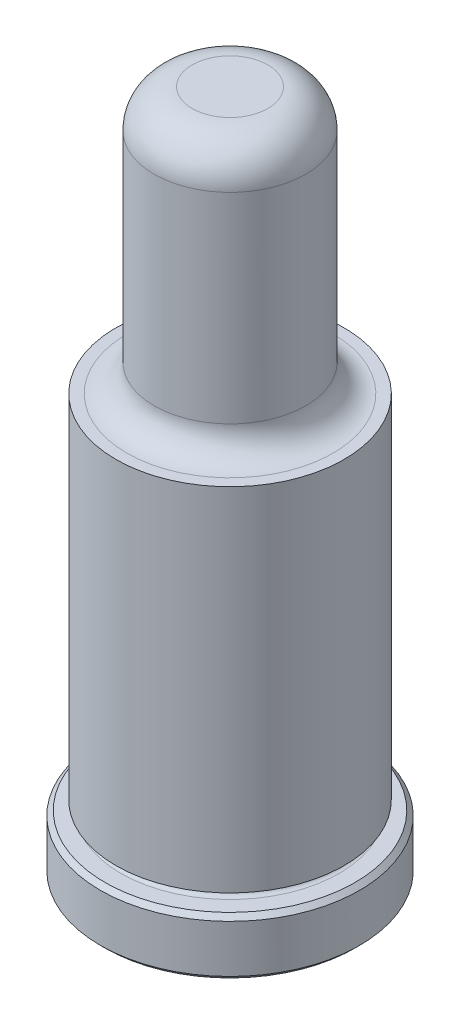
SolidWorks part; units mm, degrees
ref_plane "Front Plane" through (0, 0, 0) normal (0, 0, 1) x (1, 0, 0)
ref_plane "Top Plane" through (0, 0, 0) normal (0, 1, 0) x (1, 0, 0)
ref_plane "Right Plane" through (0, 0, 0) normal (1, 0, 0) x (0, 0, -1)
sketch "Sketch1" plane through (0, 0, 0) normal (1, 0, 0) x (0, 0, -1)
  line L0 (0, 0) -> (10.8331, 0)
  line L1 (10.8331, 0) -> (10.8331, 4.7498)
  line L2 (10.8331, 4.7498) -> (9.1313, 4.7498)
  line L3 (8.7503, 2.6782) -> (8.7503, 5.9795) construction
  line L4 (9.1313, 5.5118) -> (9.5377, 5.5118)
  line L5 (9.5377, 5.5118) -> (9.5377, 34.925)
  line L6 (9.5377, 34.925) -> (8.6233, 34.925)
  line L7 (6.3373, 37.211) -> (6.3373, 57.15)
  line L9 (6.3373, 57.15) -> (0, 57.15)
  line L10 (0, 57.15) -> (0, 0)
  line L11 (0, 0) -> (0, -7.2694) construction
  arc A0 (9.1313, 5.5118) -> (9.1313, 4.7498) centre (9.1313, 5.1308) ccw
  arc A1 (8.6233, 34.925) -> (6.3373, 37.211) centre (8.6233, 37.211) cw
  point P2 (6.3373, 57.15)
  point P14 (6.3373, 57.0292)
  point P19 (6.3373, 34.925)
  point P20 (6.3373, 57.2387)
  dimension "D14" = 0.762
  dimension "D8" = 2.286
  dimension "T" = 4.7498
  dimension "D2" = 0.762
  dimension "M" = 21.6662
  dimension "B" = 19.0754
  dimension "L" = 57.15
  dimension "D7" = 0.7874
  dimension "A" = 34.925
  dimension "D" = 12.6746
  dimension "D15" = 22.225
revolve "Revolve1" add sketch "Sketch1" angle 360 about L11
chamfer "Chamfer1" distance 0.381 angle 45 2 edges at (0, 0, 10.8331) (0, 4.7498, 10.8331)
fillet "Fillet1" radius 3.175 1 edges at (0, 57.15, 6.3373)
